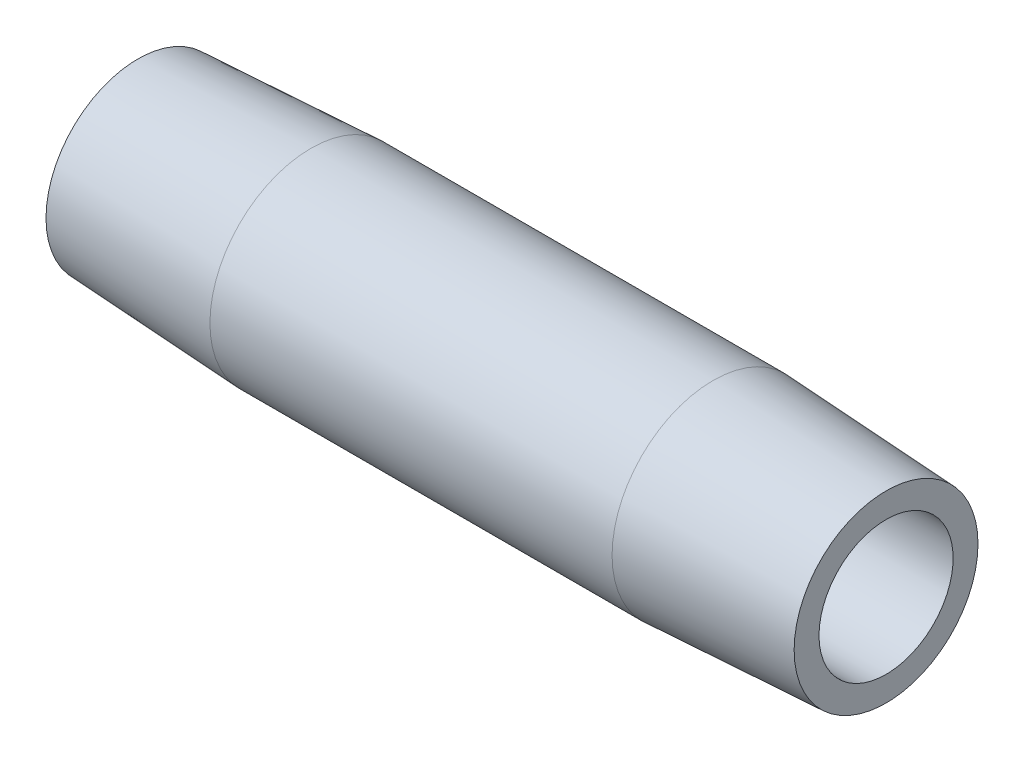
SolidWorks part; units mm, degrees
ref_plane "Front Plane" through (0, 0, 0) normal (0, 0, 1) x (1, 0, 0)
ref_plane "Top Plane" through (0, 0, 0) normal (0, 1, 0) x (1, 0, 0)
ref_plane "Right Plane" through (0, 0, 0) normal (1, 0, 0) x (0, 0, -1)
sketch "Sketch2" plane through (0, 0, 0) normal (0, 0, 1) x (1, 0, 0)
  line L0 (0.4761, 0) -> (50000.4761, 0) construction
  line L1 (0, -11.3625) -> (0, 49988.6375) construction
  line L7 (8.81, 5.1435) -> (0, 4.6818)
  line L8 (29.29, 5.1435) -> (8.81, 5.1435)
  line L9 (38.1, 4.6818) -> (29.29, 5.1435)
  line L10 (38.1, 3.4163) -> (38.1, 4.6818)
  line L11 (38.1, 3.4163) -> (0, 3.4163)
  line L12 (0, 4.6818) -> (0, 3.4163)
  dimension "D1" = 6.8326
  dimension "D2" = 10.287
  dimension "D3" = 3
  dimension "D4" = 3
  dimension "D5" = 8.81
  dimension "D6" = 8.81
  dimension "D7" = 38.1
revolve "Revolve1" add sketch "Sketch2" angle 360 about L0
